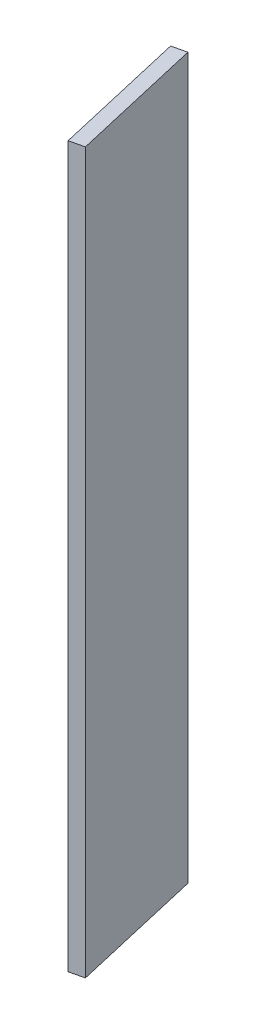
SolidWorks part; units mm, degrees
ref_plane "Alzado" through (0, 0, 0) normal (0, 0, 1) x (1, 0, 0)
ref_plane "Planta" through (0, 0, 0) normal (0, 1, 0) x (1, 0, 0)
ref_plane "Vista lateral" through (0, 0, 0) normal (1, 0, 0) x (0, 0, -1)
sketch "Croquis2" plane through (0, 0, 0) normal (0, 1, 0) x (1, 0, 0)
  line L0 (390, 0) -> (411.3617, -92.5672)
  line L1 (390, 0) -> (380.2561, -2.2486)
  line L2 (411.3617, -92.5672) -> (401.6177, -94.8158)
  line L3 (380.2561, -2.2486) -> (401.6177, -94.8158)
  line L4 (390, 10) -> (415.4316, -100.2037) construction
  dimension "D1" = 10
  dimension "D2" = 95
extrude "Saliente-Extruir1" add sketch "Croquis2" along normal up to surface (500 mm away)
